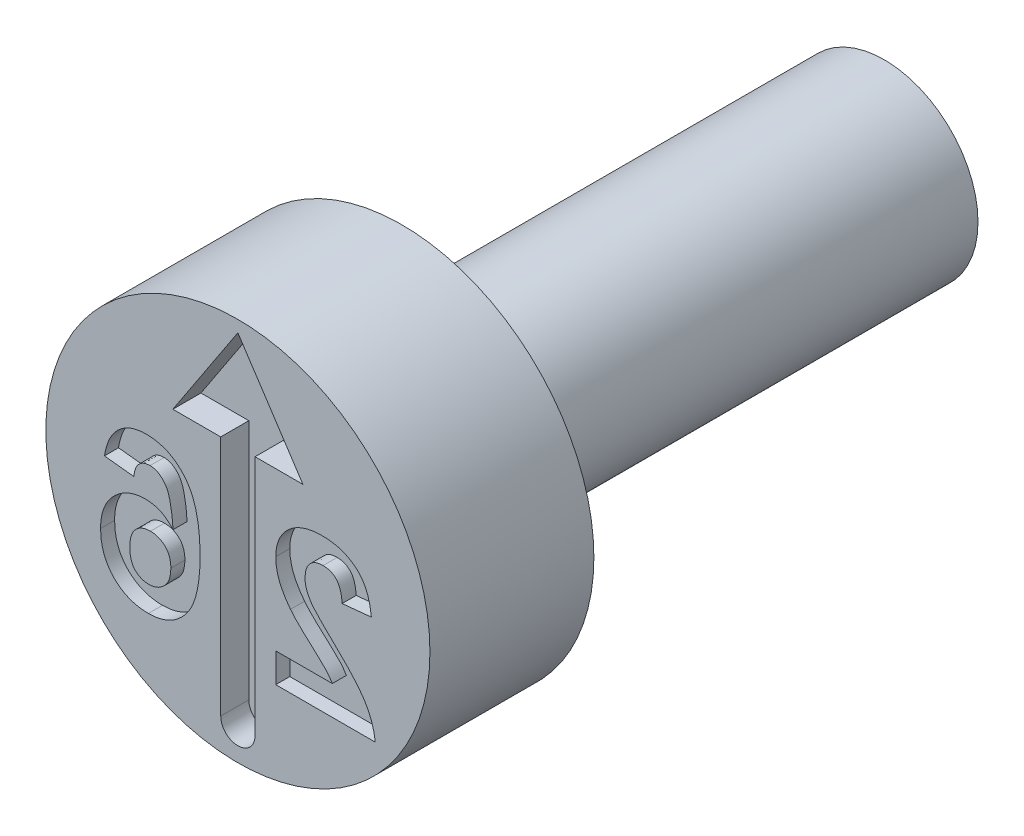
SolidWorks part; units mm, degrees
ref_plane "Front Plane" through (0, 0, 0) normal (0, 0, 1) x (1, 0, 0)
ref_plane "Top Plane" through (0, 0, 0) normal (0, 1, 0) x (1, 0, 0)
ref_plane "Right Plane" through (0, 0, 0) normal (1, 0, 0) x (0, 0, -1)
sketch "Sketch2" plane through (0, 0, 0) normal (1, 0, 0) x (0, 0, -1)
  line L0 (0.4039, 0) -> (50000.4039, 0) construction
  line L6 (0, 4.1) -> (0, 0)
  line L7 (3.5, 4.1) -> (0, 4.1)
  line L8 (3.5, 2) -> (3.5, 4.1)
  line L9 (13.8, 2) -> (3.5, 2)
  line L10 (13.8, 0) -> (13.8, 2)
  line L11 (0, 0) -> (13.8, 0)
  dimension "D1" = 8.2
  dimension "D2" = 4
  dimension "D3" = 13.8
  dimension "D4" = 3.5
revolve "Revolve1" add sketch "Sketch2" angle 360 about L0
sketch "Sketch3" plane through (0, 0, 0) normal (0, 0, 1) x (1, 0, 0)
  line L0 (0, 0) -> (0, 192375) construction
  line L1 (0.3664, 1.7436) -> (0.3664, -3.4169)
  line L2 (1.3888, 1.7436) -> (0.3664, 1.7436)
  line L3 (0, 3.8516) -> (1.3888, 1.7436)
  line L15 (0, 3.8516) -> (-1.3888, 1.7436)
  line L16 (-1.3888, 1.7436) -> (-0.3664, 1.7436)
  line L17 (-0.3664, 1.7436) -> (-0.3664, -3.4169)
  arc A2 (-0.3664, -3.4169) -> (0.3664, -3.4169) centre (0, -3.4169) ccw
extrude "Cut-Extrude4" cut sketch "Sketch3" against normal blind 0.6
sketch "Sketch4" plane through (0, 0, 0) normal (0, 0, 1) x (1, 0, 0)
  text T0 "2  6" font "Arial" height 3.25
  dimension "D1" = 2.25
  dimension "D2" = 3.1
extrude "Cut-Extrude5" cut sketch "Sketch4" against normal blind 0.3
